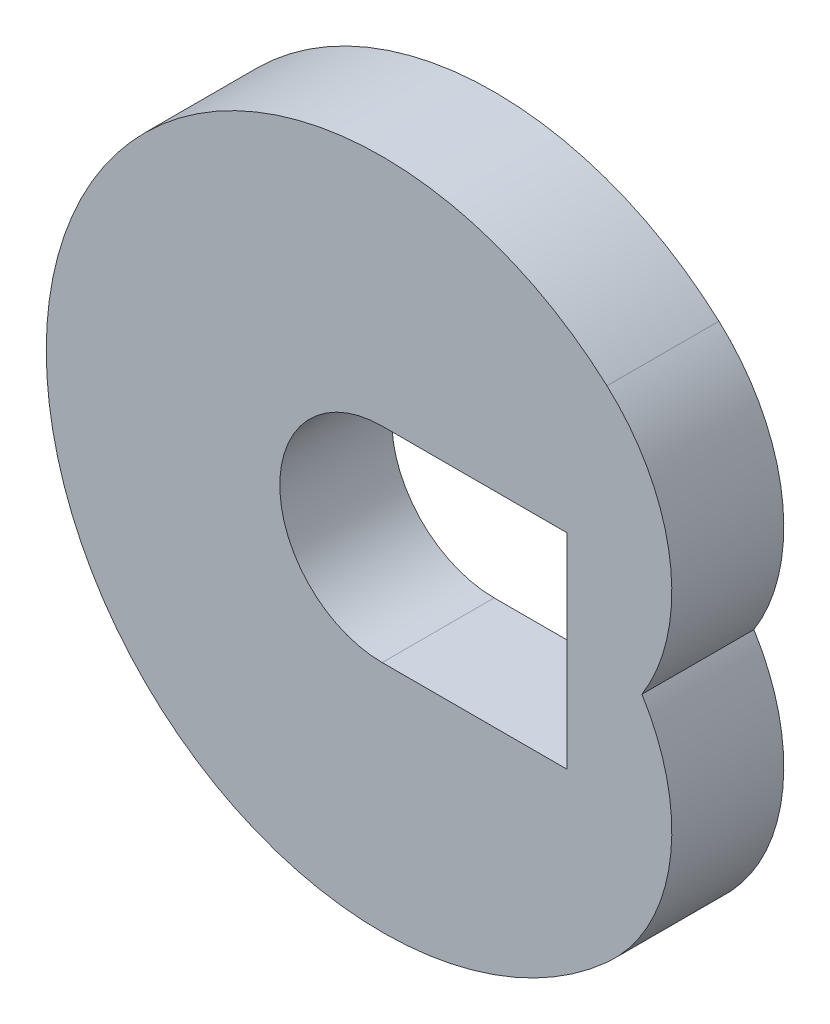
SolidWorks part; units mm, degrees
ref_plane "前视基准面" through (0, 0, 0) normal (0, 0, 1) x (1, 0, 0)
ref_plane "上视基准面" through (0, 0, 0) normal (0, 1, 0) x (1, 0, 0)
ref_plane "右视基准面" through (0, 0, 0) normal (1, 0, 0) x (0, 0, -1)
sketch "草图1" plane through (0, 0, 0) normal (0, 0, 1) x (1, 0, 0)
  line L0 (0, 0) -> (401.4784, 445.8869) construction
  line L1 (0, 0) -> (401.4784, -445.8869) construction
  line L2 (0, 0) -> (-791.161, 0) construction
  line L3 (0, 0) -> (-250, 0) construction
  line L4 (0, 182.8813) -> (330, 182.8813)
  line L5 (330, 182.8813) -> (330, -182.8813)
  line L6 (330, -182.8813) -> (0, -182.8813)
  arc A0 (401.4784, 445.8869) -> (401.4784, -445.8869) centre (0, 0) ccw
  arc A1 (401.4784, 445.8869) -> (463.9028, 0) centre (167.2827, 185.7862) cw
  arc A2 (401.4784, -445.8869) -> (463.9028, 0) centre (167.2827, -185.7862) ccw
  arc A3 (0, 182.8813) -> (0, -182.8813) centre (0, 0) ccw
  dimension "D1" = 600
  dimension "D2" = 250
  dimension "D3" = 132
  dimension "D4" = 330
extrude "凸台-拉伸1" add sketch "草图1" along normal blind 200 contours A0 A2 A1 | L4 L5 L6 A3
